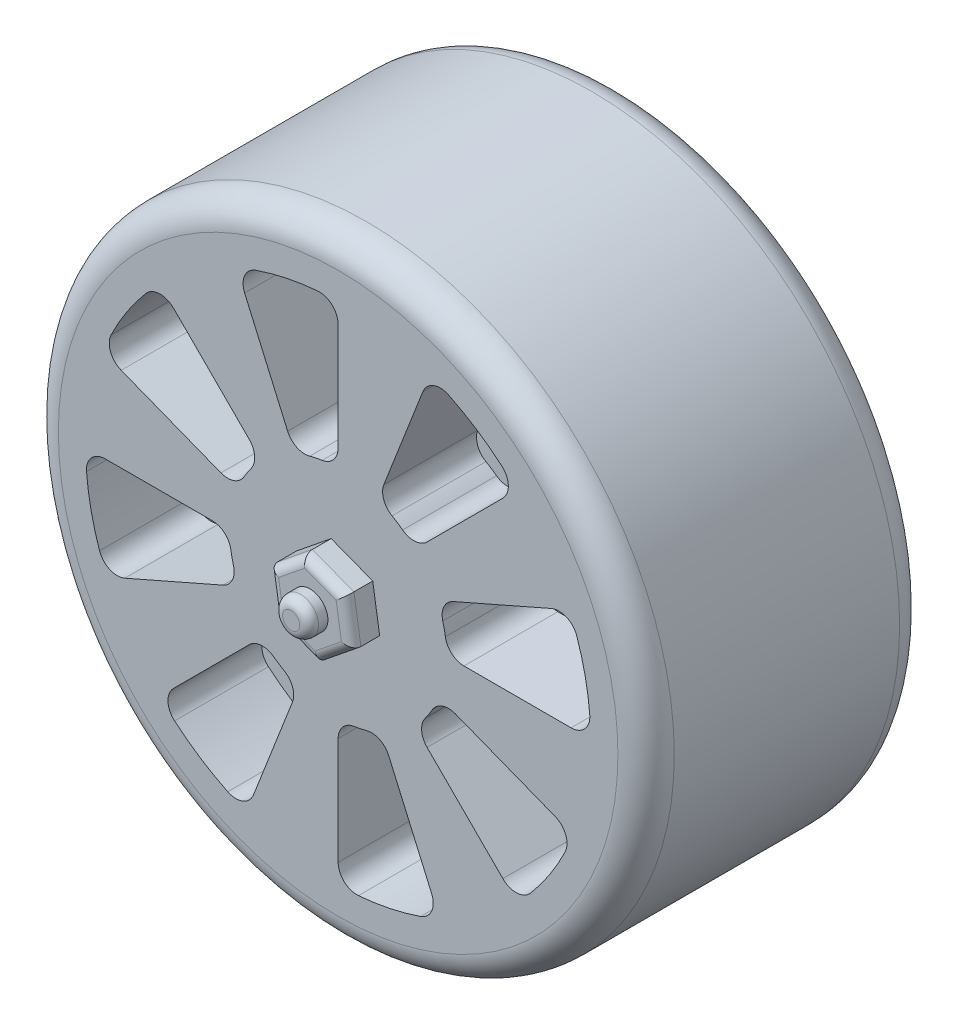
SolidWorks part; units mm, degrees
ref_plane "Plan de face" through (0, 0, 0) normal (0, 0, 1) x (1, 0, 0)
ref_plane "Plan de dessus" through (0, 0, 0) normal (0, 1, 0) x (1, 0, 0)
ref_plane "Plan de droite" through (0, 0, 0) normal (1, 0, 0) x (0, 0, -1)
sketch "Esquisse1"
sketch "Esquisse2" plane through (0, 0, 0) normal (0, 0, 1) x (1, 0, 0)
  circle A0 centre (116.8437, 87.5221) radius 32.7952
extrude "Boss.-Extru.1" add sketch "Esquisse2" along normal blind 30
fillet "Congé1" radius 3 2 edges at (149.6389, 87.5221, 0) (149.6389, 87.5221, 30)
sketch "Esquisse3" plane through (0, 0, 30) normal (0, 0, 1) x (1, 0, 0)
  line L0 (111.4645, 99.7915) -> (106.8845, 110.2379)
  line L1 (116.8437, 100.9189) -> (116.8437, 112.3252)
  arc A0 (114.683, 114.3187) -> (108.063, 112.9313) centre (116.8437, 87.5221) ccw
  arc A1 (115.139, 98.9408) -> (113.82, 98.6643) centre (116.8437, 87.5221) ccw
  arc A2 (113.82, 98.6643) -> (111.4645, 99.7915) centre (113.2962, 100.5945) cw
  arc A3 (115.139, 98.9408) -> (116.8437, 100.9189) centre (114.8437, 100.9189) ccw
  arc A4 (114.683, 114.3187) -> (116.8437, 112.3252) centre (114.8437, 112.3252) cw
  arc A5 (106.8845, 110.2379) -> (108.063, 112.9313) centre (108.7162, 111.041) cw
  dimension "D1" = 2
extrude "Enlèv. mat.-Extru.1" cut sketch "Esquisse3" against normal blind 10
pattern_circular "Répétition circulaire1" count 8 over 360 about axis through (116.8437, 87.5221, 0) along (0, 0, 1) of "Enlèv. mat.-Extru.1"
sketch "Esquisse4" plane through (0, 0, 30) normal (0, 0, 1) x (1, 0, 0)
  line L1 (121.2661, 85.8248) -> (120.5248, 90.5033)
  line L2 (120.5248, 90.5033) -> (116.1024, 92.2007)
  line L3 (116.1024, 92.2007) -> (112.4213, 89.2194)
  line L4 (112.4213, 89.2194) -> (113.1626, 84.5409)
  line L5 (113.1626, 84.5409) -> (117.585, 82.8435)
  line L6 (117.585, 82.8435) -> (121.2661, 85.8248)
  circle A0 centre (116.8437, 87.5221) radius 4.1023 construction
extrude "Boss.-Extru.2" add sketch "Esquisse4" along normal blind 3
sketch "Esquisse5" plane through (0, 0, 33) normal (0, 0, 1) x (1, 0, 0)
  circle A0 centre (116.8437, 87.5221) radius 1.9119
extrude "Boss.-Extru.3" add sketch "Esquisse5" along normal blind 2
fillet "Congé2" radius 1 1 edges at (118.7556, 87.5221, 35)
fillet "Congé3" radius 1 6 edges at (114.2619, 90.7101, 33) (112.7919, 86.8802, 33) (115.3738, 83.6922, 33) (119.4255, 84.3341, 33) (120.8955, 88.1641, 33) (118.3136, 91.352, 33)
scale "Echelle1" scale about centroid uniform scaling yes scale factor 20
